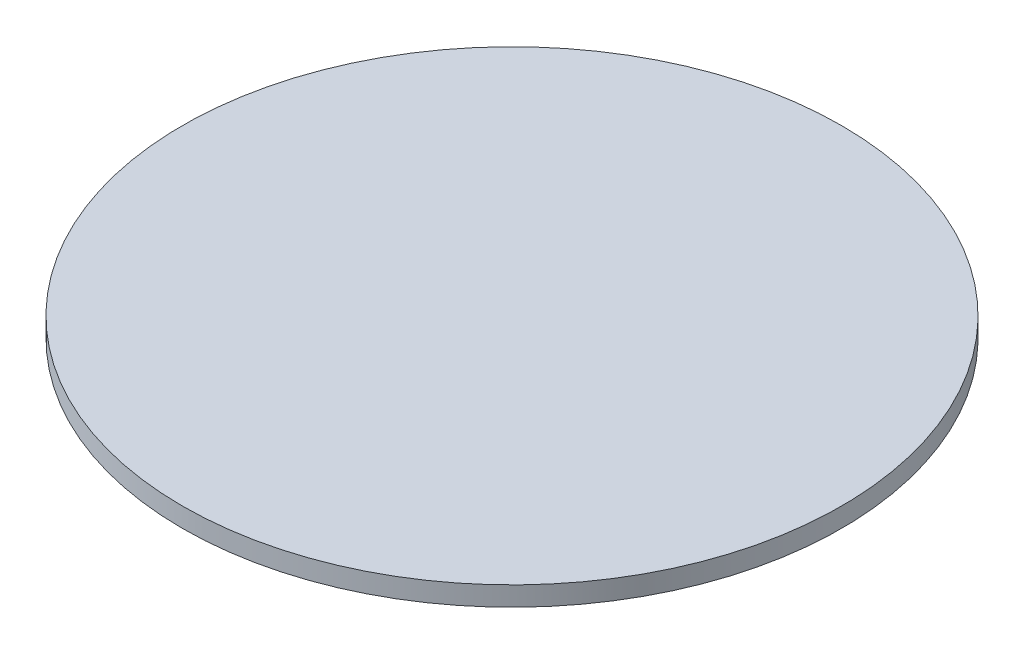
SolidWorks part; units mm, degrees
ref_plane "Front Plane" through (0, 0, 0) normal (0, 0, 1) x (1, 0, 0)
ref_plane "Top Plane" through (0, 0, 0) normal (0, 1, 0) x (1, 0, 0)
ref_plane "Right Plane" through (0, 0, 0) normal (1, 0, 0) x (0, 0, -1)
sketch "Sketch1" plane through (0, 0, 0) normal (0, 1, 0) x (1, 0, 0)
  circle A0 centre (0, 0) radius 85
  dimension "D1" = 170
extrude "Boss-Extrude1" add sketch "Sketch1" along normal blind 5
sketch "Sketch2" plane through (0, 0, 0) normal (0, 1, 0) x (1, 0, 0)
  line L1 (-68, -51) -> (68, -51)
  line L2 (-68, -51) -> (-68, 51)
  line L3 (-68, 51) -> (68, 51)
  line L4 (68, -51) -> (68, 51)
  line L5 (-68, -51) -> (68, 51) construction
  line L6 (-68, 51) -> (68, -51) construction
  circle A0 centre (0, 0) radius 85 construction
  point P0 (0, 0)
  dimension "D1" = 136
  dimension "D2" = 102
